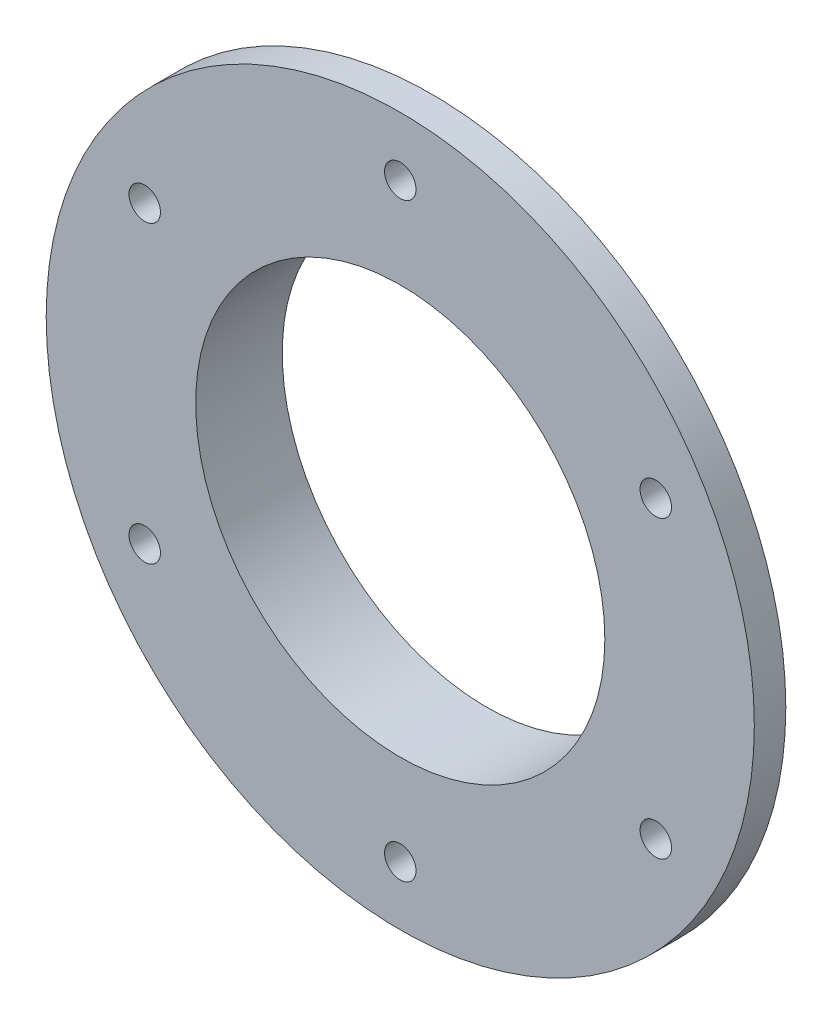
SolidWorks part; units mm, degrees
ref_plane "Front Plane" through (0, 0, 0) normal (0, 0, 1) x (1, 0, 0)
ref_plane "Top Plane" through (0, 0, 0) normal (0, 1, 0) x (1, 0, 0)
ref_plane "Right Plane" through (0, 0, 0) normal (1, 0, 0) x (0, 0, -1)
sketch "Sketch1" plane through (0, 0, 0) normal (1, 0, 0) x (0, 0, -1)
  line L0 (0, 52) -> (0, 90)
  line L1 (0, 90) -> (8, 90)
  line L2 (8, 90) -> (8, 60)
  line L3 (8, 60) -> (22, 60)
  line L4 (22, 60) -> (22, 52)
  line L5 (22, 52) -> (0, 52)
  line L6 (0, 0) -> (22, 0) construction
  point P9 (22, 0)
  dimension "D1" = 22
  dimension "D2" = 52
  dimension "D3" = 60
  dimension "D4" = 90
  dimension "D5" = 8
revolve "Revolve1" add sketch "Sketch1" angle 360 about L6
sketch "Sketch2" plane through (0, 0, 0) normal (0, 0, 1) x (1, 0, 0)
  line L0 (0, 0) -> (0, 75) construction
  circle A0 centre (0, 75) radius 4
  dimension "D1" = 8
  dimension "D2" = 75
extrude "Cut-Extrude1" cut sketch "Sketch2" against normal through all
pattern_circular "CirPattern1" count 6 over 360 about axis through (0, 0, 0) along (0, 0, 1) of "Cut-Extrude1"
